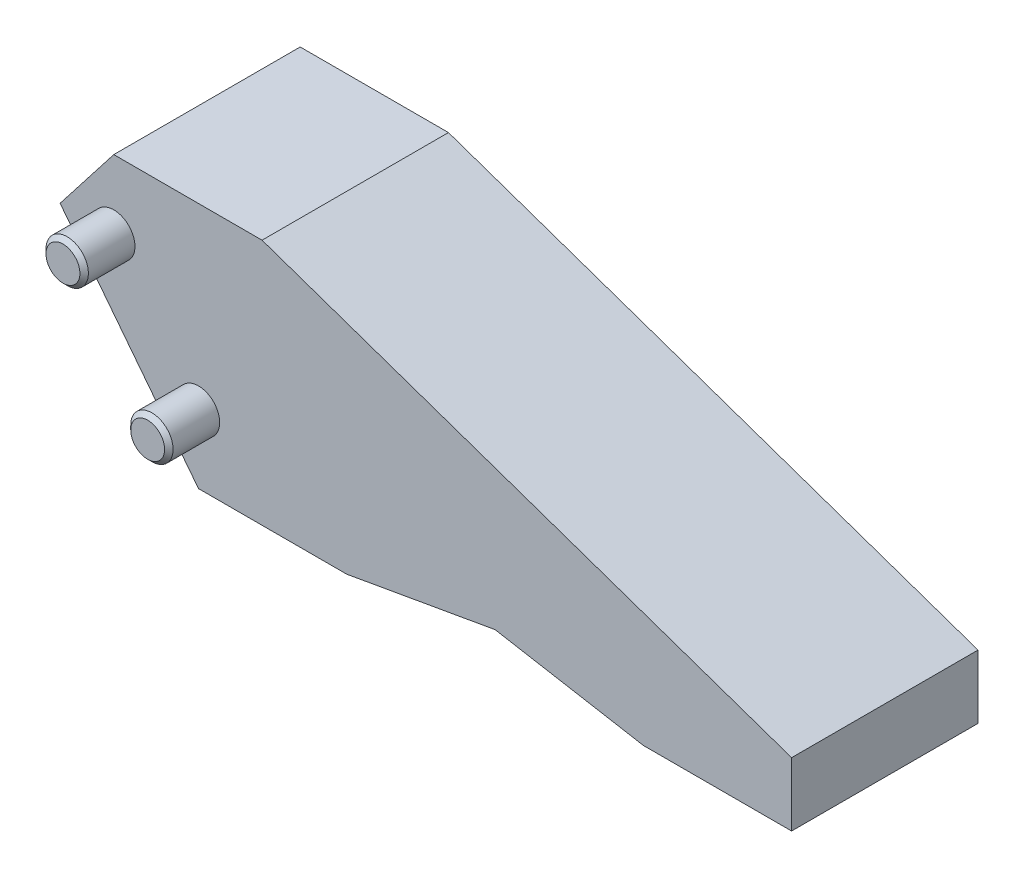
SolidWorks part; units mm, degrees
ref_plane "Plan 1" through (0, 0, 0) normal (0, 0, 1) x (1, 0, 0)
ref_plane "Plan 2" through (0, 0, 0) normal (0, 1, 0) x (1, 0, 0)
ref_plane "Plan 3" through (0, 0, 0) normal (1, 0, 0) x (0, 0, -1)
sketch "Esquisse1" plane through (0, 0, 0) normal (0, 0, 1) x (1, 0, 0)
  line L0 (0, 16.2875) -> (35, 16.2875)
  line L1 (35, 16.2875) -> (160, -27)
  line L2 (160, -27) -> (160, -42)
  line L3 (160, -42) -> (125, -42)
  line L4 (125, -42) -> (90, -35.8286)
  line L5 (90, -35.8286) -> (55, -42)
  line L6 (55, -42) -> (20, -42)
  line L7 (20, -42) -> (-12.6689, 0)
  line L8 (-12.6689, 0) -> (0, 16.2875)
  circle A0 centre (0, 0) radius 5
  circle A1 centre (20, -26) radius 5
  dimension "D1" = 10
  dimension "D2" = 20
  dimension "D3" = 26
  dimension "D4" = 10
  dimension "D5" = 10
  dimension "D6" = 16
  dimension "D7" = 160
  dimension "D8" = 35
  dimension "D9" = 170
  dimension "D10" = 35
  dimension "D11" = 35
  dimension "D12" = 15
extrude "Base-Extrusion" add sketch "Esquisse1" along normal mid plane 44
sketch "Esquisse2" plane through (0, 0, 0) normal (0, 0, 1) x (1, 0, 0)
  circle A0 centre (20, -26) radius 5 construction
  circle A1 centre (0, 0) radius 5 construction
  circle A2 centre (20, -26) radius 5
  circle A3 centre (0, 0) radius 5
extrude "Axes" add sketch "Esquisse2" along normal mid plane 68
chamfer "Chanfrein1" distance 1 angle 45
sketch "Point serrage" plane through (0, 0, 0) normal (0, 0, 1) x (1, 0, 0)
  point P1 (90, -35.8286)
